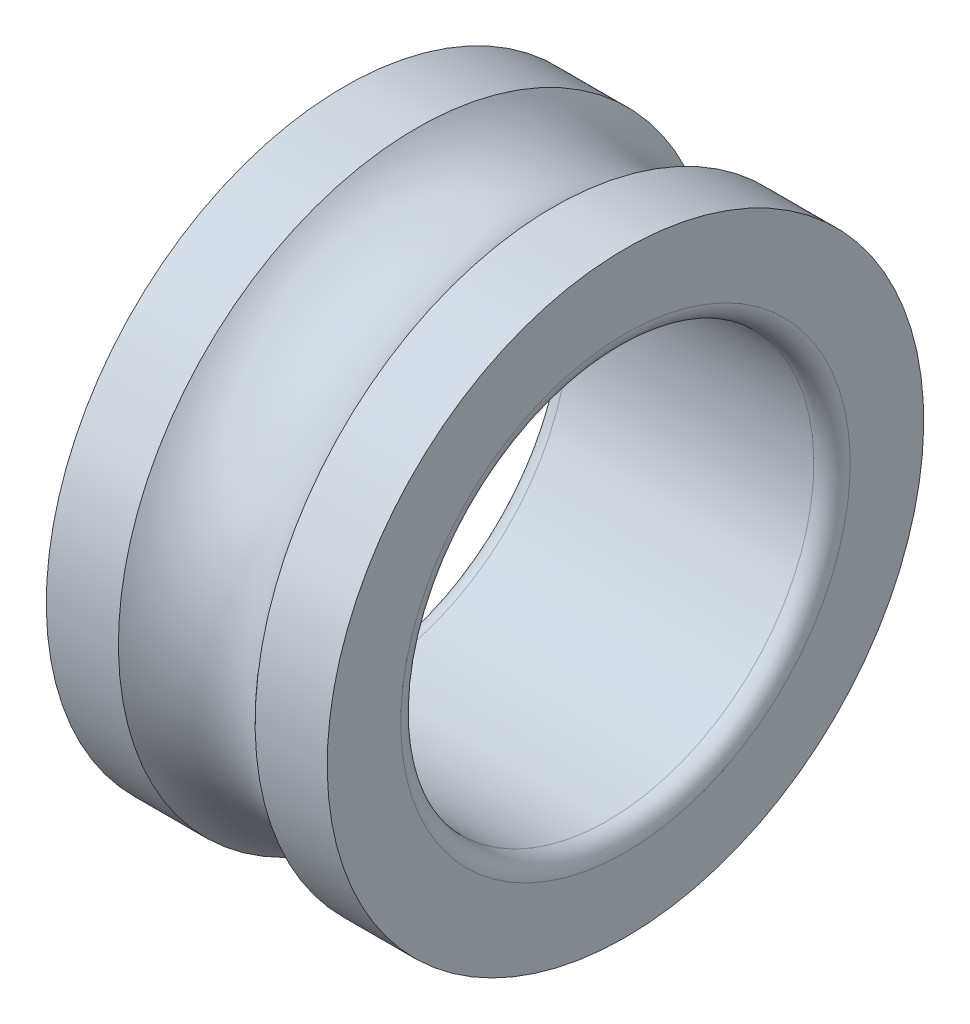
SolidWorks part; units mm, degrees
ref_plane "Plan de face" through (0, 0, 0) normal (0, 0, 1) x (1, 0, 0)
ref_plane "Plan de dessus" through (0, 0, 0) normal (0, 1, 0) x (1, 0, 0)
ref_plane "Plan de droite" through (0, 0, 0) normal (1, 0, 0) x (0, 0, -1)
sketch "Esquisse1" plane through (0, 0, 0) normal (0, 0, 1) x (1, 0, 0)
  line L0 (8.5, 31) -> (8.5, 12.5) construction
  line L1 (1.1, 31) -> (15.9, 31) construction
  line L2 (0, 29.9) -> (0, 13.6) construction
  line L3 (1.1, 12.5) -> (15.9, 12.5)
  line L4 (17, 29.9) -> (17, 13.6) construction
  line L5 (17, 25.45) -> (0, 25.45) construction
  line L6 (17, 18.05) -> (12.6367, 18.05)
  line L7 (0, 0) -> (17, 0) construction
  line L8 (17, 18.05) -> (17, 13.6)
  line L9 (0, 18.05) -> (0, 13.6)
  line L10 (4.3633, 18.05) -> (0, 18.05)
  arc A1 (0, 13.6) -> (1.1, 12.5) centre (1.1, 13.6) ccw
  arc A2 (1.1, 31) -> (0, 29.9) centre (1.1, 29.9) ccw construction
  arc A3 (17, 29.9) -> (15.9, 31) centre (15.9, 29.9) ccw construction
  arc A4 (15.9, 12.5) -> (17, 13.6) centre (15.9, 13.6) ccw
  arc A5 (4.3633, 18.05) -> (12.6367, 18.05) centre (8.5, 21.75) ccw
  dimension "D4" = 1.1
  dimension "D5" = 11.1
  dimension "D1" = 12.5
  dimension "D2" = 31
  dimension "D3" = 17
  dimension "D6" = 18.05
  dimension "D7" = 25.45
revolve "Révolution1" add sketch "Esquisse1" angle 360 about L7
